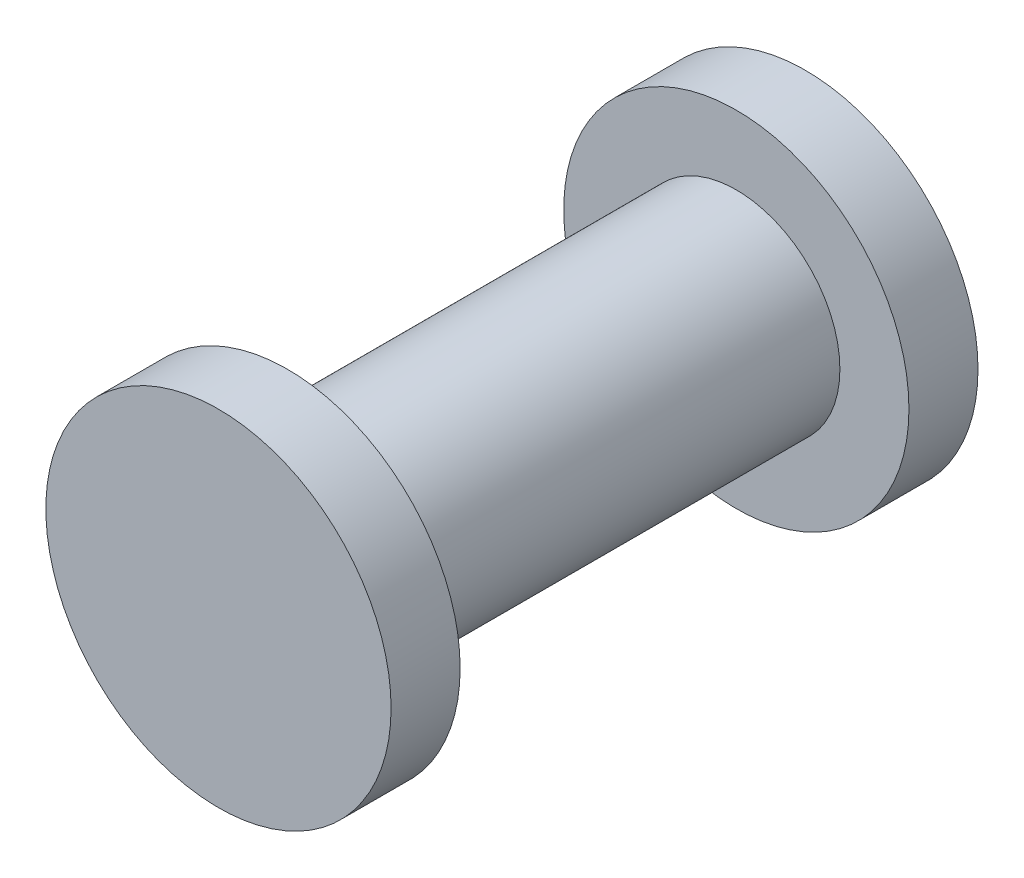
SolidWorks part; units mm, degrees
ref_plane "前视基准面" through (0, 0, 0) normal (0, 0, 1) x (1, 0, 0)
ref_plane "上视基准面" through (0, 0, 0) normal (0, 1, 0) x (1, 0, 0)
ref_plane "右视基准面" through (0, 0, 0) normal (1, 0, 0) x (0, 0, -1)
other "Configuration Table"
sketch "草图1" plane through (0, 0, 0) normal (0, 0, 1) x (1, 0, 0)
  circle A0 centre (0, 0) radius 5
  dimension "D1" = 10
extrude "Retained_Pin_D6" add sketch "草图1" against normal mid plane 17
sketch "草图2" plane through (0, 0, 0) normal (0, 0, 1) x (1, 0, 0)
  circle A0 centre (0, 0) radius 5.1
  circle A1 centre (0, 0) radius 3
  dimension "D1" = 6
  dimension "D2" = 10.2
extrude "Shaft_D6_EndCaps_D10" cut sketch "草图2" against normal mid plane 13
